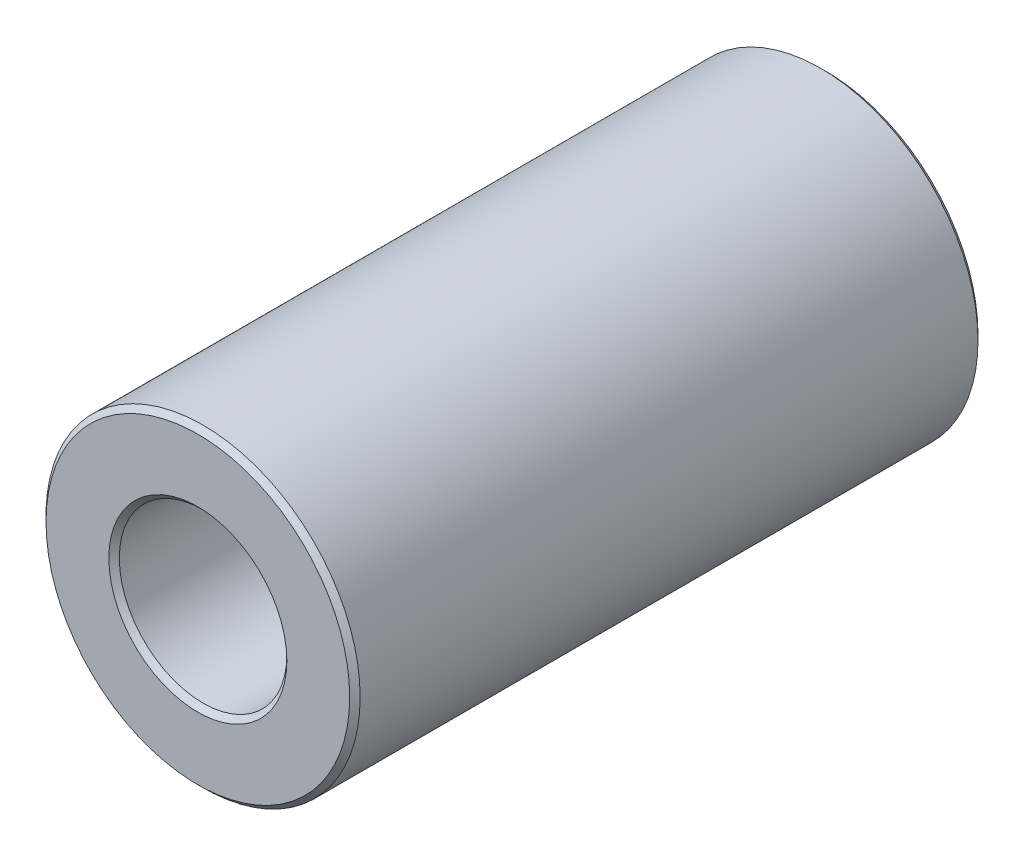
SolidWorks part; units mm, degrees
ref_plane "Front Plane" through (0, 0, 0) normal (0, 0, 1) x (1, 0, 0)
ref_plane "Top Plane" through (0, 0, 0) normal (0, 1, 0) x (1, 0, 0)
ref_plane "Right Plane" through (0, 0, 0) normal (1, 0, 0) x (0, 0, -1)
sketch "Sketch1" plane through (0, 0, 0) normal (0, 0, 1) x (1, 0, 0)
  circle A0 centre (0, 0) radius 3
  circle A1 centre (0, 0) radius 1.6
  dimension "D1" = 6
  dimension "D2" = 3.2
extrude "Boss-Extrude2" add sketch "Sketch1" along normal mid plane 12
chamfer "Chamfer3" distance 0.1 angle 45 4 edges at (3, 0, 6) (3, 0, -6) (1.6, 0, -6) (1.6, 0, 6)
